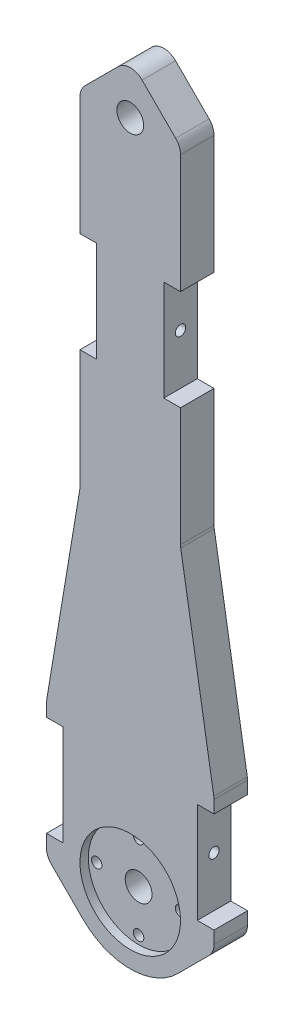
SolidWorks part; units mm, degrees
ref_plane "Alzado" through (0, 0, 0) normal (0, 0, 1) x (1, 0, 0)
ref_plane "Planta" through (0, 0, 0) normal (0, 1, 0) x (1, 0, 0)
ref_plane "Vista lateral" through (0, 0, 0) normal (1, 0, 0) x (0, 0, -1)
sketch "Croquis1" plane through (0, 0, 0) normal (0, 0, 1) x (1, 0, 0)
  line L0 (0, 0) -> (0, 66.3393) construction
  line L8 (-1.4406, -20) -> (49998.5594, -20) construction
  line L20 (-3.8, 10.35) -> (-3.8, 24.5)
  line L21 (3.8, 24.5) -> (3.8, 10.35)
  line L80 (20, 32.5444) -> (25, 32.5444)
  line L81 (25, 32.5444) -> (25, 36.3019)
  line L82 (24.932, 37.1239) -> (15.068, 96.3075)
  line L83 (15, 97.1295) -> (15, 132.5292)
  line L84 (15, 132.5292) -> (10, 132.5292)
  line L85 (10, 132.5292) -> (10, 162.5292)
  line L86 (10, 162.5292) -> (15, 162.5292)
  line L87 (15, 162.5292) -> (15, 197.9289)
  line L88 (13.5355, 201.4645) -> (3.5355, 211.4645)
  line L89 (-3.5355, 211.4645) -> (-13.5355, 201.4645)
  line L90 (-15, 197.9289) -> (-15, 162.5292)
  line L91 (-15, 162.5292) -> (-10, 162.5292)
  line L92 (-10, 162.5292) -> (-10, 132.5292)
  line L93 (-10, 132.5292) -> (-15, 132.5292)
  line L94 (-15, 132.5292) -> (-15, 97.1295)
  line L95 (-15.068, 96.3075) -> (-24.932, 37.1239)
  line L96 (-25, 36.3019) -> (-25, 32.5444)
  line L97 (-25, 32.5444) -> (-20, 32.5444)
  line L98 (-20, 32.5444) -> (-20, 2.5444)
  line L99 (-20, 2.5444) -> (-25, 2.5444)
  line L100 (-25, 2.5444) -> (-25, -1.2132)
  line L101 (-23.5355, -4.7487) -> (-14.1421, -14.1421)
  line L102 (14.1421, -14.1421) -> (23.5355, -4.7487)
  line L103 (25, -1.2132) -> (25, 2.5444)
  line L104 (25, 2.5444) -> (20, 2.5444)
  line L105 (20, 2.5444) -> (20, 32.5444)
  arc A2 (6.6178, -9.8987) -> (9.5257, 7.1443) centre (0, 0) ccw construction
  arc A11 (0, 11.9071) -> (-9.5257, 7.1443) centre (0, 0) ccw construction
  arc A12 (9.5257, 7.1443) -> (0, 11.9071) centre (0, 0) ccw construction
  arc A15 (0, 28.3) -> (-3.8, 24.5) centre (0, 24.5) ccw
  arc A16 (3.8, 24.5) -> (0, 28.3) centre (0, 24.5) ccw
  arc A17 (3.8, 10.35) -> (5.8, 4.35) centre (13.8, 10.35) ccw
  arc A18 (-5.8, 4.35) -> (-3.8, 10.35) centre (-13.8, 10.35) ccw
  arc A19 (0, -7.25) -> (5.8, 4.35) centre (0, 0) ccw
  arc A20 (-5.8, 4.35) -> (0, -7.25) centre (0, 0) ccw
  arc A35 (25, 36.3019) -> (24.932, 37.1239) centre (20, 36.3019) ccw
  arc A36 (15, 97.1295) -> (15.068, 96.3075) centre (20, 97.1295) ccw
  arc A37 (15, 197.9289) -> (13.5355, 201.4645) centre (10, 197.9289) ccw
  arc A38 (3.5355, 211.4645) -> (-3.5355, 211.4645) centre (0, 207.9289) ccw
  arc A39 (-13.5355, 201.4645) -> (-15, 197.9289) centre (-10, 197.9289) ccw
  arc A40 (-15.068, 96.3075) -> (-15, 97.1295) centre (-20, 97.1295) ccw
  arc A41 (-24.932, 37.1239) -> (-25, 36.3019) centre (-20, 36.3019) ccw
  arc A42 (-25, -1.2132) -> (-23.5355, -4.7487) centre (-20, -1.2132) ccw
  arc A43 (-14.1421, -14.1421) -> (14.1421, -14.1421) centre (0, 0) ccw
  arc A44 (23.5355, -4.7487) -> (25, -1.2132) centre (20, -1.2132) ccw
  dimension "D1" = 11.9071
extrude "Saliente-Extruir1" add sketch "Croquis1" along normal blind 10
sketch "Croquis2" plane through (0, 0, 0) normal (0, 0, 1) x (1, 0, 0)
  line L2 (3.8, 10.35) -> (3.8, 24.5)
  line L3 (-3.8, 24.5) -> (-3.8, 10.35)
  arc A6 (1.8, 10.35) -> (-1.8, 10.35) centre (0, 10.35) ccw
  arc A12 (-4.2, 3.15) -> (-1.8, 10.35) centre (-13.8, 10.35) ccw
  arc A13 (1.8, 10.35) -> (4.2, 3.15) centre (13.8, 10.35) ccw
  arc A14 (-4.2, 3.15) -> (4.2, 3.15) centre (0, 0) ccw
  arc A17 (3.8, 24.5) -> (-3.8, 24.5) centre (0, 24.5) ccw
  arc A18 (-5.8, 4.35) -> (-3.8, 10.35) centre (-13.8, 10.35) ccw
  arc A19 (-5.8, 4.35) -> (5.8, 4.35) centre (0, 0) ccw
  arc A20 (3.8, 10.35) -> (5.8, 4.35) centre (13.8, 10.35) ccw
  circle A21 centre (0, 24.5) radius 1.55
  circle A22 centre (0, 20.5) radius 1.55
  dimension "D3" = 3.1
extrude "Saliente-Extruir2" add sketch "Croquis2" along normal blind 4
sketch "Croquis3" plane through (0, 0, 10) normal (0, 0, -1) x (-1, 0, 0)
  line L0 (12, 9) -> (4.2, 3.15)
  line L1 (4.2, 3.15) -> (0, 0) construction
  line L2 (0, 0) -> (-4.2, 3.15) construction
  line L3 (-4.2, 3.15) -> (-12, 9)
  arc A0 (-4.2, 3.15) -> (4.2, 3.15) centre (0, 0) ccw construction
  arc A1 (-4.2, 3.15) -> (4.2, 3.15) centre (0, 0) ccw construction
  arc A2 (12, 9) -> (-12, 9) centre (0, 0) cw
  arc A3 (-4.2, 3.15) -> (4.2, 3.15) centre (0, 0) ccw
  dimension "D1" = 15
  dimension "D2" = 9.75
extrude "Cortar-Extruir1" cut sketch "Croquis3" along normal blind 2
fillet "Redondeo1" radius 2 2 edges at (-12, 9, 9) (12, 9, 9)
sketch "Croquis6" plane through (0, 0, 0) normal (0, 0, -1) x (-1, 0, 0)
  line L2 (-3.8, 24.5) -> (-3.8, 10.35)
  line L6 (-3.8, 24.5) -> (-3.8, 10.35)
  line L8 (3.8, 10.35) -> (3.8, 24.5)
  line L9 (3.8, 10.35) -> (3.8, 24.5)
  arc A4 (-5.8, 4.35) -> (-3.8, 10.35) centre (-13.8, 10.35) ccw
  arc A6 (-5.8, 4.35) -> (-3.8, 10.35) centre (-13.8, 10.35) ccw
  arc A12 (3.8, 24.5) -> (-3.8, 24.5) centre (0, 24.5) ccw
  arc A14 (3.8, 24.5) -> (-3.8, 24.5) centre (0, 24.5) ccw
  arc A16 (3.8, 10.35) -> (5.8, 4.35) centre (13.8, 10.35) ccw
  arc A17 (3.8, 10.35) -> (5.8, 4.35) centre (13.8, 10.35) ccw
  arc A18 (-5.8, 4.35) -> (5.8, 4.35) centre (0, 0) ccw
  arc A19 (-5.8, 4.35) -> (5.8, 4.35) centre (0, 0) ccw
  dimension "D1" = 0
extrude "Saliente-Extruir3" add sketch "Croquis6" against normal up to surface (4 mm away)
sketch "Croquis7" plane through (0, 0, 8) normal (0, 0, 1) x (1, 0, 0)
  circle A0 centre (0, 0) radius 15
  dimension "D1" = 30
extrude "Cortar-Extruir3" cut sketch "Croquis7" along normal through all
sketch "Croquis8" plane through (0, 0, 8) normal (0, 0, 1) x (1, 0, 0)
  line L0 (3.8, 10.35) -> (3.8, 14.5107) construction
  line L1 (-3.8, 14.5107) -> (-3.8, 10.35) construction
  line L4 (3.8, 10.35) -> (3.8, 14.5107)
  line L5 (-3.8, 14.5107) -> (-3.8, 10.35)
  line L6 (-3.8, 24.5) -> (-3.8, 14.5107)
  line L7 (3.8, 14.5107) -> (3.8, 24.5)
  arc A1 (3.8, 10.35) -> (5.8, 4.35) centre (13.8, 10.35) ccw construction
  arc A2 (-5.8, 4.35) -> (-3.8, 10.35) centre (-13.8, 10.35) ccw construction
  arc A3 (3.8, 24.5) -> (-3.8, 24.5) centre (0, 24.5) ccw construction
  arc A4 (3.8, 10.35) -> (5.8, 4.35) centre (13.8, 10.35) ccw
  arc A5 (-5.8, 4.35) -> (-3.8, 10.35) centre (-13.8, 10.35) ccw
  arc A6 (3.8, 24.5) -> (-3.8, 24.5) centre (0, 24.5) ccw
  arc A7 (-5.8, 4.35) -> (5.8, 4.35) centre (0, 0) ccw construction
  arc A8 (-5.8, 4.35) -> (5.8, 4.35) centre (0, 0) ccw
extrude "Saliente-Extruir4" add sketch "Croquis8" against normal up to surface (4 mm away) contours A8 A4 L4 L7 A6 L6 L5 A5
sketch "Croquis9" plane through (0, 0, 10) normal (0, 0, 1) x (1, 0, 0)
  line L0 (-3.8, 24.5) -> (-3.8, 14.5107) construction
  line L2 (3.8, 14.5107) -> (3.8, 24.5)
  line L3 (-3.8, 24.5) -> (-3.8, 14.5107)
  arc A0 (3.8, 14.5107) -> (-3.8, 14.5107) centre (0, 0) ccw
  arc A1 (3.8, 24.5) -> (-3.8, 24.5) centre (0, 24.5) ccw construction
  arc A2 (3.8, 24.5) -> (-3.8, 24.5) centre (0, 24.5) ccw
extrude "Saliente-Extruir5" add sketch "Croquis9" against normal up to surface (2 mm away)
sketch "Croquis4" plane through (0, 0, 8) normal (0, 0, 1) x (1, 0, 0)
  circle A0 centre (0, 0) radius 12.5 construction
  circle A1 centre (-12.5, 0) radius 1.55
  circle A2 centre (0, -12.5) radius 1.55
  circle A3 centre (12.5, 0) radius 1.55
  circle A4 centre (0, 12.5) radius 1.55
  dimension "D1" = 3.1
  dimension "D2" = 25
extrude "Cortar-Extruir2" cut sketch "Croquis4" against normal through all
sketch "Croquis10" plane through (0, 0, 8) normal (0, 0, 1) x (1, 0, 0)
  circle A0 centre (0, 0) radius 4
  dimension "D1" = 8
extrude "Cortar-Extruir4" cut sketch "Croquis10" against normal through all
sketch "Croquis11" plane through (0, 0, 0) normal (0, 0, -1) x (-1, 0, 0)
  circle A0 centre (12.5, 0) radius 2.875
  circle A1 centre (0, -12.5) radius 2.875
  circle A2 centre (0, 12.5) radius 2.875
  circle A3 centre (-12.5, 0) radius 2.875
  circle A8 centre (0, 0) radius 12.5 construction
  dimension "D1" = 5.75
extrude "Cortar-Extruir5" cut sketch "Croquis11" against normal blind 3.3
sketch "Croquis12" plane through (0, 0, 10) normal (0, 0, 1) x (1, 0, 0)
  line L2 (15, 200) -> (0, 215) construction
  line L3 (0, 215) -> (-15, 200) construction
  line L4 (-7.5, 207.5) -> (0, 200) construction
  line L5 (0, 200) -> (7.5, 207.5) construction
  line L6 (13.5355, 201.4645) -> (3.5355, 211.4645) construction
  line L7 (-3.5355, 211.4645) -> (-13.5355, 201.4645) construction
  circle A0 centre (0, 200) radius 4
  point P11 (0, 200)
  dimension "D1" = 8
extrude "Cortar-Extruir6" cut sketch "Croquis12" against normal through all
sketch "Croquis16" plane through (-10, 0, 0) normal (1, 0, 0) x (0, 0, -1)
  line L0 (-5, 162.5292) -> (-5, 132.5292) construction
  line L3 (-10, 132.5292) -> (0, 132.5292) construction
  line L4 (-10, 162.5292) -> (0, 162.5292) construction
  circle A0 centre (-5, 147.5292) radius 1.55
  dimension "D1" = 3.1
extrude "Cortar-Extruir10" cut sketch "Croquis16" along normal through all
sketch "Croquis17" plane through (-20, 0, 0) normal (1, 0, 0) x (0, 0, -1)
  line L0 (-5, 32.5444) -> (-5, 2.5444) construction
  line L3 (-10, 2.5444) -> (0, 2.5444) construction
  line L4 (-10, 32.5444) -> (0, 32.5444) construction
  circle A0 centre (-5, 17.5444) radius 1.55
  circle A2 centre (-5, 147.5292) radius 1.55 construction
extrude "Cortar-Extruir11" cut sketch "Croquis17" along normal through all both and the other way through all
sketch "Croquis19" plane through (0, 0, 8) normal (0, 0, 1) x (1, 0, 0)
  circle A1 centre (0, 0) radius 15
  circle A2 centre (0, 0) radius 15
  dimension "D1" = 0
extrude "Cortar-Extruir13" cut sketch "Croquis19" against normal blind 0.5
